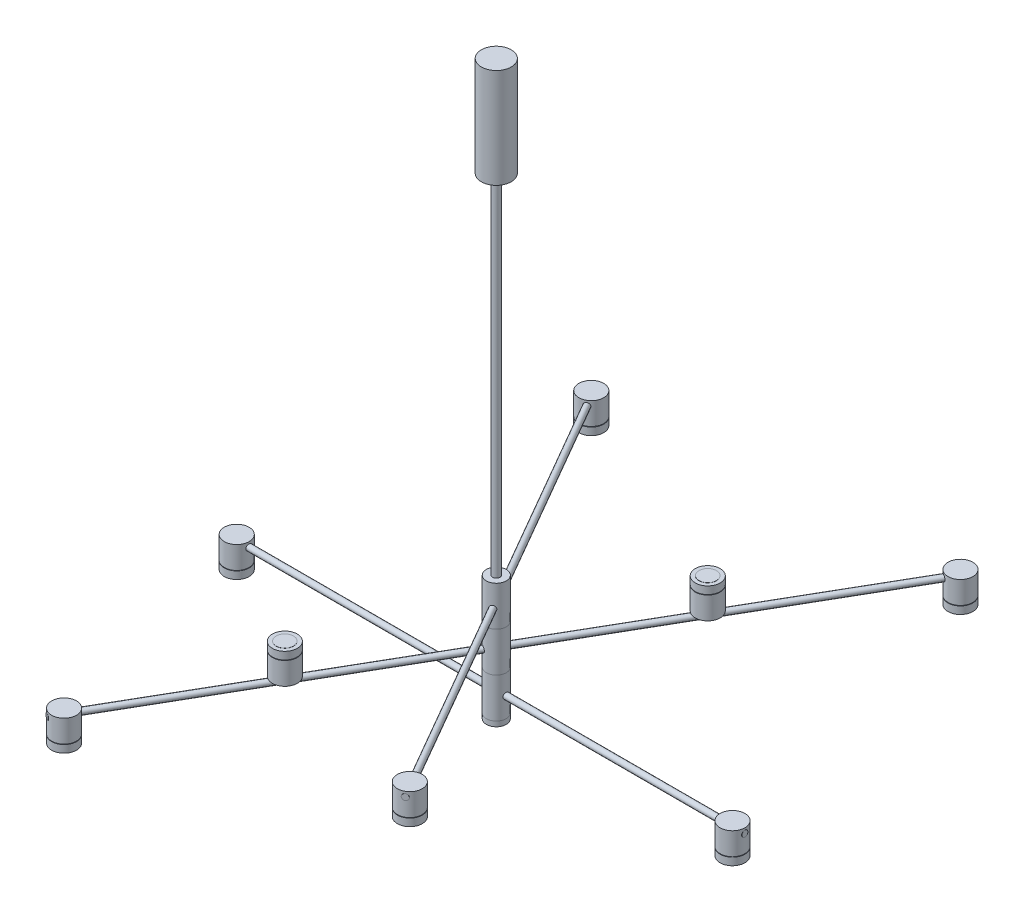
SolidWorks part; units mm, degrees
ref_plane "Alzado" through (0, 0, 0) normal (0, 0, 1) x (1, 0, 0)
ref_plane "Planta" through (0, 0, 0) normal (0, 1, 0) x (1, 0, 0)
ref_plane "Vista lateral" through (0, 0, 0) normal (1, 0, 0) x (0, 0, -1)
sketch "Croquis1" plane through (0, 0, 0) normal (0, 1, 0) x (1, 0, 0)
  circle A0 centre (0, 0) radius 20
  dimension "D1" = 40
extrude "Saliente-Extruir1" add sketch "Croquis1" along normal blind 80
sketch "Croquis2" plane through (0, 80, 0) normal (0, 1, 0) x (1, 0, 0)
  circle A1 centre (0, 0) radius 20
  circle A2 centre (0, 0) radius 20
  dimension "D1" = 0
extrude "Saliente-Extruir2" add sketch "Croquis2" along normal blind 80 separate body
sketch "Croquis3" plane through (0, 160, 0) normal (0, 1, 0) x (1, 0, 0)
  circle A1 centre (0, 0) radius 20
  circle A2 centre (0, 0) radius 20
  dimension "D1" = 0
extrude "Saliente-Extruir3" add sketch "Croquis3" along normal blind 80 separate body
sketch "Croquis4" plane through (0, 0, 0) normal (0, 0, 1) x (1, 0, 0)
  line L0 (0, 80) -> (0, 0) construction
  line L1 (20, 80) -> (-20, 80) construction
  line L2 (-500, 40) -> (500, 40)
  point P8 (0, 40)
  dimension "D1" = 1000
sweep "Barrer1" add path "Croquis4" parameters "D3"=12
ref_plane "Plano1" through (0, 40, 0) normal (0, -1, 0) x (-1, 0, 0)
sketch "Croquis17" plane through (0, 40, 0) normal (0, -1, 0) x (-1, 0, 0)
  line L0 (19.0788, -6) -> (500, -6) construction
  line L1 (-500, 0) -> (-475, 0) construction
  line L2 (-500, 6) -> (-500, -6) construction
  circle A0 centre (522, 0) radius 25
  circle A1 centre (-475, 0) radius 25
  dimension "D1" = 50
  dimension "D4" = 50
  dimension "D2" = 22
  dimension "D3" = 6
  dimension "D5" = 25
extrude "Saliente-Extruir4" add sketch "Croquis17" along normal blind 35 and the other way blind 10 separate body
ref_plane "Plano2" through (0, 115, 0) normal (0, -1, 0) x (-1, 0, 0)
sketch "Croquis18" plane through (0, 115, 0) normal (0, -1, 0) x (-1, 0, 0)
  line L0 (330.6384, -572.6825) -> (-330.6384, 572.6825)
  line L1 (0, 0) -> (-125.2308, 0) construction
  point P4 (0, 0)
  dimension "D1" = 120
sweep "Barrer2" add path "Croquis18" parameters "D3"=12
ref_plane "Plano3" through (0, 195, 0) normal (0, -1, 0) x (-1, 0, 0)
sketch "Croquis31" plane through (0, 195, 0) normal (0, -1, 0) x (-1, 0, 0)
  line L0 (250, 433.0127) -> (-250, -433.0127)
  line L1 (0, 0) -> (176.6642, 0) construction
  point P5 (0, 0)
  dimension "D1" = 1000
  dimension "D2" = 60
sweep "Barrer3" add path "Croquis31" parameters "D3"=12
ref_plane "Plano4" through (0, 110, 0) normal (0, -1, 0) x (-1, 0, 0)
sketch "Croquis44" plane through (0, 115, 0) normal (0, -1, 0) x (-1, 0, 0)
  line L0 (-330.6384, 572.6825) -> (-341.6384, 591.735) construction
  line L1 (-325.4422, 575.6825) -> (-335.8345, 569.6825) construction
  line L2 (330.6384, -572.6825) -> (318.1384, -551.0318) construction
  line L3 (325.4422, -575.6825) -> (335.8345, -569.6825) construction
  line L4 (-335.8345, 569.6825) -> (325.4422, -575.6825) construction
  circle A0 centre (-341.6384, 591.735) radius 25
  circle A1 centre (318.1384, -551.0318) radius 25
  dimension "D1" = 50
  dimension "D3" = 50
  dimension "D2" = 22
  dimension "D4" = 25
extrude "Saliente-Extruir5" add sketch "Croquis44" along normal blind 35 and the other way blind 10 separate body
ref_plane "Plano5" through (0, 195, 0) normal (0, -1, 0) x (-1, 0, 0)
sketch "Croquis45" plane through (0, 195, 0) normal (0, -1, 0) x (-1, 0, 0)
  line L0 (255.1962, 430.0127) -> (244.8038, 436.0127) construction
  line L1 (14.7355, 13.5227) -> (255.1962, 430.0127) construction
  line L2 (-255.1962, -430.0127) -> (-244.8038, -436.0127) construction
  line L3 (-244.8038, -436.0127) -> (-4.3432, -19.5227) construction
  circle A0 centre (261, 452.0653) radius 25
  circle A1 centre (-237.5, -411.3621) radius 25
  dimension "D3" = 50
  dimension "D5" = 50
  dimension "D1" = 22
  dimension "D2" = 6
  dimension "D4" = 25
  dimension "D6" = 6
extrude "Saliente-Extruir6" add sketch "Croquis45" along normal blind 35 and the other way blind 10 separate body
ref_plane "Plano6" through (0, 121, 0) normal (0, -1, 0) x (-1, 0, 0)
sketch "Croquis46" plane through (0, 121, 0) normal (0, -1, 0) x (-1, 0, 0)
  line L0 (-335.8345, 569.6825) -> (325.4422, -575.6825) construction
  line L3 (-325.4422, 575.6825) -> (-335.8345, 569.6825) construction
  line L4 (335.8345, -569.6825) -> (-325.4422, 575.6825) construction
  line L5 (325.4422, -575.6825) -> (335.8345, -569.6825) construction
  circle A0 centre (-155.6384, 269.5736) radius 25
  circle A1 centre (155.6384, -269.5736) radius 25
  dimension "D1" = 50
  dimension "D4" = 50
  dimension "D2" = 6
  dimension "D3" = 350
  dimension "D5" = 6
  dimension "D6" = 350
extrude "Saliente-Extruir7" add sketch "Croquis46" against normal blind 45 separate body
sketch "Croquis53" plane through (0, 240, 0) normal (0, 1, 0) x (1, 0, 0)
  circle A0 centre (0, 0) radius 7.5
  dimension "D1" = 15
extrude "Saliente-Extruir8" add sketch "Croquis53" along normal blind 700 separate body
sketch "Croquis54" plane through (0, 940, 0) normal (0, 1, 0) x (1, 0, 0)
  circle A0 centre (0, 0) radius 30
  dimension "D1" = 60
extrude "Saliente-Extruir9" add sketch "Croquis54" along normal blind 200
sketch "Croquis55" plane through (0, 80, 0) normal (0, -1, 0) x (1, 0, 0)
  circle A0 centre (341.6384, -591.735) radius 17.0401
  circle A1 centre (-318.1384, 551.0318) radius 17.2582
sketch "Croquis56" plane through (0, 160, 0) normal (0, -1, 0) x (1, 0, 0)
  circle A0 centre (-261, -452.0653) radius 23
  circle A1 centre (237.5, 411.3621) radius 24
  dimension "D1" = 46
  dimension "D2" = 48
extrude "Saliente-Extruir10" add sketch "Croquis56" along normal blind 1 separate body
sketch "Croquis57" plane through (0, 159, 0) normal (0, -1, 0) x (1, 0, 0)
  circle A0 centre (-261, -452.0653) radius 25
  circle A1 centre (237.5, 411.3621) radius 25
extrude "Saliente-Extruir11" add sketch "Croquis57" along normal blind 15 separate body
sketch "Croquis58" plane through (0, 5, 0) normal (0, -1, 0) x (1, 0, 0)
  circle A0 centre (475, 0) radius 24
  circle A1 centre (-522, 0) radius 24
  dimension "D1" = 48
  dimension "D2" = 48
extrude "Saliente-Extruir12" add sketch "Croquis58" along normal blind 1 separate body
sketch "Croquis59" plane through (0, 4, 0) normal (0, -1, 0) x (1, 0, 0)
  circle A0 centre (475, 0) radius 25
  circle A1 centre (-522, 0) radius 25
extrude "Saliente-Extruir13" add sketch "Croquis59" along normal blind 15 separate body
sketch "Croquis64" plane through (0, 80, 0) normal (0, -1, 0) x (1, 0, 0)
  circle A0 centre (341.6384, -591.735) radius 24
  circle A1 centre (-318.1384, 551.0318) radius 24
  dimension "D1" = 48
  dimension "D2" = 48
extrude "Saliente-Extruir14" add sketch "Croquis64" along normal blind 1 separate body
sketch "Croquis65" plane through (0, 79, 0) normal (0, -1, 0) x (1, 0, 0)
  circle A0 centre (-318.1384, 551.0318) radius 25
  circle A1 centre (341.6384, -591.735) radius 25
extrude "Saliente-Extruir15" add sketch "Croquis65" along normal blind 15 separate body
sketch "Croquis66" plane through (0, 166, 0) normal (0, 1, 0) x (1, 0, 0)
  circle A0 centre (-155.6384, -269.5736) radius 24
  circle A1 centre (155.6384, 269.5736) radius 24
  dimension "D1" = 48
  dimension "D2" = 48
extrude "Saliente-Extruir16" add sketch "Croquis66" along normal blind 1 separate body
sketch "Croquis67" plane through (0, 167, 0) normal (0, 1, 0) x (1, 0, 0)
  circle A0 centre (155.6384, 269.5736) radius 25
  circle A1 centre (-155.6384, -269.5736) radius 25
  dimension "D1" = 50
  dimension "D2" = 50
extrude "Saliente-Extruir17" add sketch "Croquis67" along normal blind 15 separate body
sketch "Croquis68" plane through (0, 144, 0) normal (0, -1, 0) x (1, 0, 0)
  circle A0 centre (-261, -452.0653) radius 17.5
  circle A1 centre (237.5, 411.3621) radius 17.5
  dimension "D1" = 35
  dimension "D2" = 35
extrude "Saliente-Extruir18" add sketch "Croquis68" along normal blind 0.25 separate body
sketch "Croquis69" plane through (0, -11, 0) normal (0, -1, 0) x (1, 0, 0)
  circle A0 centre (475, 0) radius 17.5
  circle A1 centre (-522, 0) radius 17.5
  dimension "D1" = 35
  dimension "D2" = 35
extrude "Saliente-Extruir19" add sketch "Croquis69" along normal blind 0.25 separate body
sketch "Croquis70" plane through (0, 64, 0) normal (0, -1, 0) x (1, 0, 0)
  circle A0 centre (-318.1384, 551.0318) radius 17.5
  circle A1 centre (341.6384, -591.735) radius 17.5
  dimension "D1" = 35
  dimension "D2" = 35
extrude "Saliente-Extruir20" add sketch "Croquis70" along normal blind 0.25 separate body
sketch "Croquis71" plane through (0, 182, 0) normal (0, 1, 0) x (1, 0, 0)
  circle A0 centre (155.6384, 269.5736) radius 17.5
  circle A1 centre (-155.6384, -269.5736) radius 17.5
  dimension "D1" = 35
  dimension "D2" = 35
extrude "Saliente-Extruir21" add sketch "Croquis71" along normal blind 0.25 separate body
sketch "Croquis84" plane through (0, 0, 0) normal (0, -1, 0) x (1, 0, 0)
  circle A1 centre (0, 0) radius 20
  circle A2 centre (0, 0) radius 20
  dimension "D1" = 0
extrude "Saliente-Extruir22" add sketch "Croquis84" along normal blind 10 separate body
